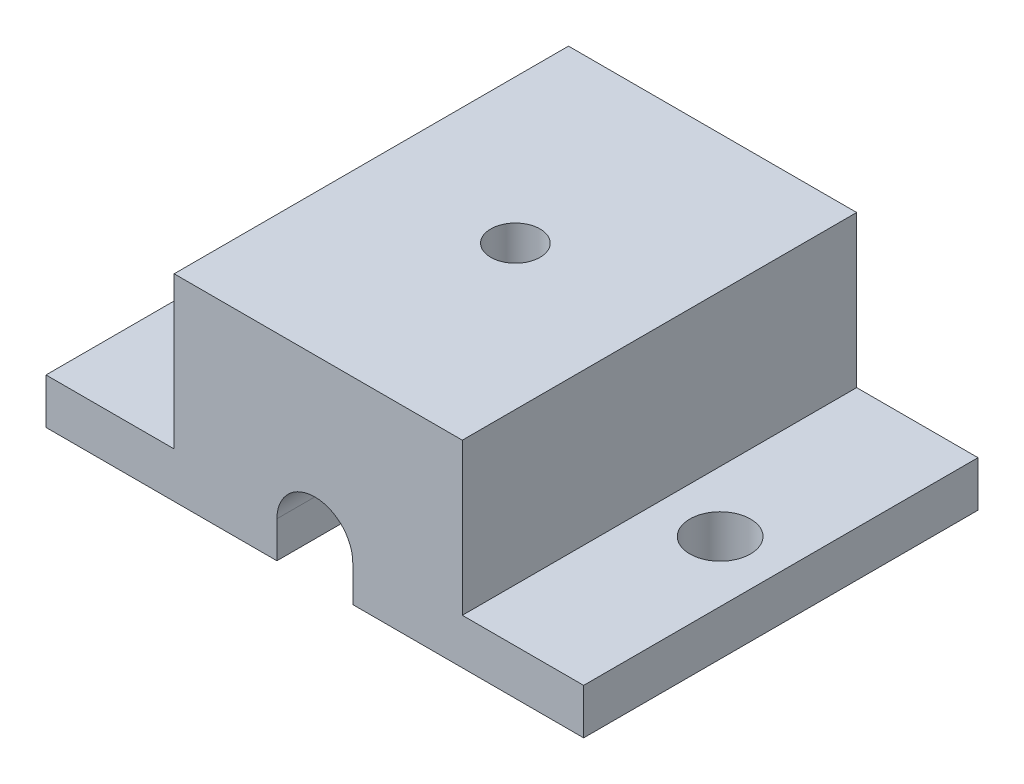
SolidWorks part; units mm, degrees
ref_plane "Front Plane" through (0, 0, 0) normal (0, 0, 1) x (1, 0, 0)
ref_plane "Top Plane" through (0, 0, 0) normal (0, 1, 0) x (1, 0, 0)
ref_plane "Right Plane" through (0, 0, 0) normal (1, 0, 0) x (0, 0, -1)
sketch "Sketch1" plane through (0, 0, 0) normal (0, 0, 1) x (1, 0, 0)
  line L5 (35.4483, 0) -> (35.4483, 3)
  line L6 (35.4483, 3) -> (27.4483, 3)
  line L7 (27.4483, 3) -> (27.4483, 13)
  line L8 (27.4483, 13) -> (8.4483, 13)
  line L9 (8.4483, 13) -> (8.4483, 3)
  line L10 (8.4483, 3) -> (0, 3)
  line L11 (0, 3) -> (0, 0)
  line L12 (35.4483, 0) -> (0, 0)
  dimension "D1" = 3
  dimension "D5" = 3
  dimension "D6" = 8
  dimension "D7" = 10
  dimension "D8" = 19
extrude "Boss-Extrude1" add sketch "Sketch1" along normal blind 26
sketch "Sketch2" plane through (0, 3, 0) normal (0, 1, 0) x (1, 0, 0)
  line L0 (0, -26) -> (0, 0) construction
  line L2 (8.4483, 0) -> (0, 0) construction
  line L3 (35.4483, 0) -> (27.4483, 0) construction
  line L4 (35.4483, -26) -> (35.4483, 0) construction
  circle A0 centre (4, -13) radius 2
  circle A1 centre (31.4483, -13) radius 2
  dimension "D2" = 4
  dimension "D4" = 4
  dimension "D5" = 13
  dimension "D6" = 4
  dimension "D1" = 4
  dimension "D3" = 13
extrude "Cut-Extrude1" cut sketch "Sketch2" against normal blind 20
sketch "Sketch4" plane through (0, 0, 0) normal (0, 0, -1) x (-1, 0, 0)
  line L0 (0, 3) -> (0, 0) construction
  line L1 (0, 0) -> (-35.4483, 0) construction
  line L2 (-20.225, 2.4) -> (-20.225, 0)
  line L3 (-15.225, 2.4) -> (-15.225, 0)
  line L4 (-20.225, 0) -> (-15.225, 0)
  arc A0 (-15.225, 2.4) -> (-20.225, 2.4) centre (-17.725, 2.4) ccw
  dimension "D1" = 5
  dimension "D2" = 17.725
  dimension "D3" = 2.4
extrude "Cut-Extrude2" cut sketch "Sketch4" against normal through all
sketch "Sketch6" plane through (0, 13, 0) normal (0, 1, 0) x (1, 0, 0)
  line L0 (27.4483, -26) -> (8.4483, -26) construction
  line L1 (27.4483, -26) -> (27.4483, 0) construction
  circle A0 centre (17.9483, -13) radius 1.625
  dimension "D1" = 3.25
  dimension "D2" = 13
  dimension "D3" = 9.5
extrude "Cut-Extrude3" cut sketch "Sketch6" against normal through all
